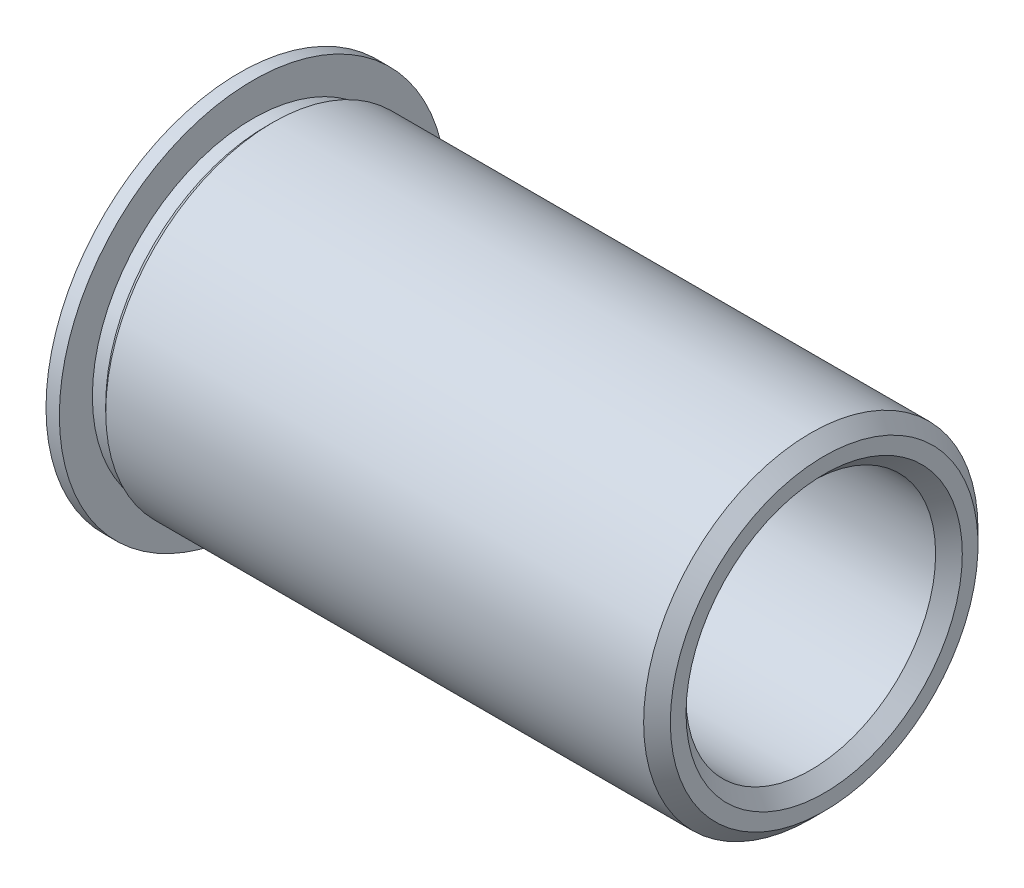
SolidWorks part; units mm, degrees
ref_plane "Front Plane" through (0, 0, 0) normal (0, 0, 1) x (1, 0, 0)
ref_plane "Top Plane" through (0, 0, 0) normal (0, 1, 0) x (1, 0, 0)
ref_plane "Right Plane" through (0, 0, 0) normal (1, 0, 0) x (0, 0, -1)
sketch "Sketch2" plane through (0, 0, 0) normal (0, 0, 1) x (1, 0, 0)
  line L0 (-56.2163, 95.4401) -> (-56.2163, 99.1231)
  line L1 (-56.2163, 99.1231) -> (-55.9623, 99.1231)
  line L2 (-56.2163, 95.4401) -> (-45.0911, 95.4401)
  line L3 (-45.0911, 95.4401) -> (-45.0911, 98.3674)
  line L4 (-45.0911, 98.3674) -> (-45.3451, 98.6214)
  line L5 (-45.3451, 98.6214) -> (-55.5813, 98.6214)
  line L6 (-55.5813, 98.6214) -> (-55.7083, 98.4944)
  line L7 (-55.7083, 98.4944) -> (-55.9623, 98.4944)
  line L8 (-55.9623, 98.4944) -> (-55.9623, 99.1231)
  dimension "D1" = 3.683
  dimension "D2" = 0.254
  dimension "D3" = 3.1813
  dimension "D4" = 0.254
  dimension "D5" = 0.254
  dimension "D6" = 11.1252
  dimension "D7" = 0.127
  dimension "D8" = 0.254
revolve "Revolve3" add sketch "Sketch2" angle 360 about L2
sketch "Sketch3" plane through (-45.0911, 0, 0) normal (1, 0, 0) x (0, 0, -1)
  circle A0 centre (0, 95.4401) radius 2.3749
  dimension "D1" = 4.7498
extrude "Cut-Extrude1" cut sketch "Sketch3" against normal through all
chamfer "Chamfer2" distance 0.254 angle 45 1 edges at (-56.2163, 95.4401, -2.3749)
chamfer "Chamfer3" distance 0.254 angle 45 1 edges at (-45.0911, 95.4401, -2.3749)
